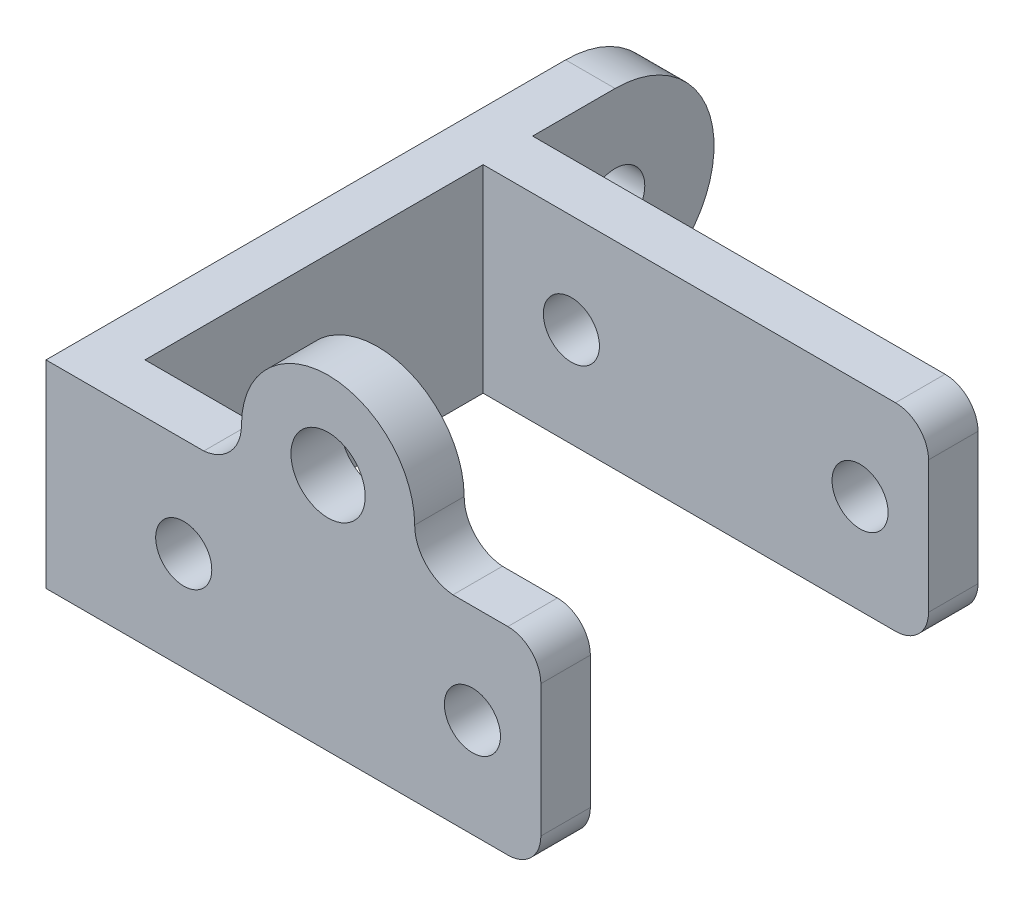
SolidWorks part; units mm, degrees
ref_plane "Front" through (0, 0, 0) normal (0, 0, 1) x (1, 0, 0)
ref_plane "Top" through (0, 0, 0) normal (0, 1, 0) x (1, 0, 0)
ref_plane "Right" through (0, 0, 0) normal (1, 0, 0) x (0, 0, -1)
sketch "Эскиз2" plane through (0, 0, 0) normal (0, 0, 1) x (1, 0, 0)
  line L1 (-15, 6) -> (15, 6)
  line L2 (-15, 6) -> (-15, -6)
  line L3 (-15, -6) -> (15, -6)
  line L4 (15, 6) -> (15, -6)
  line L5 (-15, 6) -> (15, -6) construction
  line L6 (-15, -6) -> (15, 6) construction
  point P0 (0, 0)
extrude "Бобышка-Вытянуть1" add sketch "Эскиз2" along normal blind 26.5
shell "Оболочка2" thickness 3
sketch "Эскиз4" plane through (0, 0, 26.5) normal (0, 0, 1) x (1, 0, 0)
  line L7 (2.1, 0) -> (2.1, -5.9919) construction
  circle A0 centre (-6.65, 0) radius 1.7
  circle A1 centre (10.85, 0) radius 1.7
extrude "Вырез-Вытянуть2" cut sketch "Эскиз4" against normal through all
sketch "Эскиз5" plane through (0, 0, 26.5) normal (0, 0, 1) x (1, 0, 0)
  line L0 (-4.95, 0) -> (49995.05, 0) construction
  line L4 (2.1, 0) -> (2.1, -50000) construction
  circle A6 centre (2.1, 8.5) radius 2.25
sketch "Эскиз6" plane through (0, 0, 26.5) normal (0, 0, 1) x (1, 0, 0)
  line L4 (-5.4335, 6) -> (9.6691, 6)
  arc A5 (7.35, 8.5) -> (9.6691, 6) centre (9.8571, 8.5) ccw
  arc A6 (-3.15, 8.5) -> (-5.4335, 6) centre (-5.6603, 8.5) cw
  arc A7 (-3.15, 8.5) -> (7.35, 8.5) centre (2.1, 8.5) cw
extrude "Бобышка-Вытянуть2" add sketch "Эскиз6" against normal up to vertex
sketch "Эскиз7" plane through (-15, 0, 0) normal (-1, 0, 0) x (0, 0, 1)
  line L0 (0, 0) -> (-50000, 0) construction
  line L2 (-5, 6) -> (0, 6)
  line L3 (0, 6) -> (0, -6)
  line L4 (0, -6) -> (-5, -6)
  circle A0 centre (-5, 0) radius 1.8
  arc A1 (-5, 6) -> (-5, -6) centre (-5, 0) ccw
extrude "Бобышка-Вытянуть3" add sketch "Эскиз7" against normal up to surface (3 mm away)
fillet "Скругление1" radius 2 4 edges at (15, -6, 1.5) (15, 6, 1.5) (15, -6, 25) (15, 6, 25)
ref_plane "Плоскость1" through (0, 0, 0) normal (0, 1, 0) x (1, 0, 0)
extrude "Вырез-Вытянуть4" cut sketch "Эскиз5" against normal up to next
